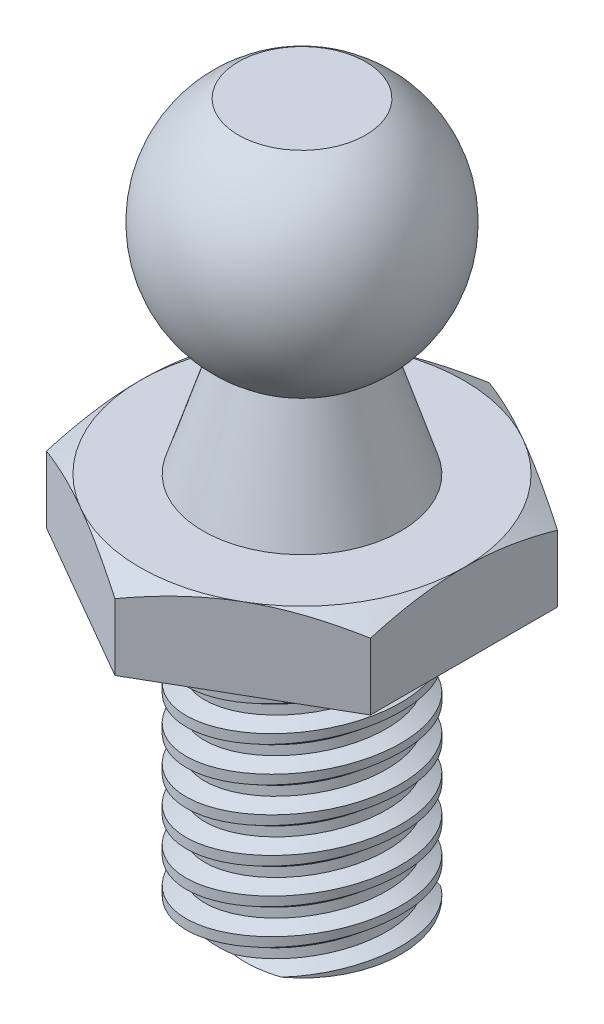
SolidWorks part; units mm, degrees
ref_plane "Front" through (0, 0, 0) normal (0, 0, 1) x (1, 0, 0)
ref_plane "Top" through (0, 0, 0) normal (0, 1, 0) x (1, 0, 0)
ref_plane "Right" through (0, 0, 0) normal (1, 0, 0) x (0, 0, -1)
sketch "Sketch1" plane through (0, 0, 0) normal (0, 0, 1) x (1, 0, 0)
  line L0 (0, -15.15) -> (0, 15.15)
  line L1 (0, 15.15) -> (2.5515, 15.15)
  line L2 (2.5515, 6.55) -> (3.9687, 2.1)
  line L3 (3.9687, 2.1) -> (6.5, 2.1)
  line L4 (6.5, 2.1) -> (6.5, -1.15)
  line L5 (6.5, -1.15) -> (3.9687, -1.15)
  line L6 (3.9687, -1.15) -> (3.9688, -15.15)
  line L7 (3.9688, -15.15) -> (0, -15.15)
  line L8 (2.5515, 6.55) -> (2.5515, 15.15) construction
  line L9 (0, -15.15) -> (0, -19.1187) construction
  line L10 (3.9687, 2.1) -> (3.9687, -1.15) construction
  line L11 (-3.9688, -1.15) -> (-3.9688, -15.15) construction
  arc A0 (2.5515, 15.15) -> (2.5515, 6.55) centre (0, 10.85) cw
revolve "Revolve1" add sketch "Sketch1" angle 360 about L9
sketch "Sketch2" plane through (0, 0, 0) normal (0, 0, 1) x (1, 0, 0)
  line L0 (3.9687, -1.15) -> (-3.9688, -1.15) construction
  line L1 (-3.9688, -1.15) -> (-3.9688, -2.5611) construction
  line L2 (-3.9688, -2.5611) -> (3.9687, -1.15) construction
  line L3 (3.9687, -1.15) -> (3.9996, -1.3237) construction
  line L4 (3.9996, -1.3237) -> (4.2157, -2.5393)
  line L5 (4.2157, -2.5393) -> (3.3866, -2.2389)
  line L6 (3.3866, -2.2389) -> (3.3248, -1.8915)
  line L7 (3.3248, -1.8915) -> (3.9996, -1.3237)
  line L8 (3.3557, -2.0652) -> (4.1077, -1.9315) construction
  line L9 (3.9687, -1.15) -> (3.9687, -1.9562) construction
  line L10 (3.9687, -1.9562) -> (-3.9688, -3.3673) construction
  line L11 (-3.9688, -3.3673) -> (-3.9688, -2.5611) construction
  line L12 (-0.2688, -1.15) -> (0.2688, -4.1735) construction
  line L13 (-3.9688, -1.15) -> (-3.9688, -15.15) construction
  line L14 (3.9687, -1.15) -> (3.9687, -15.15) construction
  line L15 (6.5, -1.15) -> (3.9687, -1.15) construction
  point P13 (0, -2.6618)
revolve "Cut-Revolve1" cut sketch "Sketch2" angle 360 about L12
sketch "Sketch3" plane through (0, 0, 0) normal (0, 0, 1) x (1, 0, 0)
  line L0 (3.3248, -15.15) -> (3.9687, -15.15)
  line L1 (3.9687, -15.15) -> (3.9687, -13.7691)
  line L2 (3.9687, -13.7691) -> (3.3248, -15.15)
  line L3 (3.9688, -15.15) -> (0, -15.15) construction
  line L4 (3.9687, -1.15) -> (3.9687, -15.15) construction
  line L5 (3.3248, -15.15) -> (3.3248, -1.8915) construction
  line L6 (0, -15.15) -> (0, 15.15) construction
  line L7 (0, -15.15) -> (0, 15.15) construction
  dimension "D1" = 25
revolve "Cut-Revolve2" cut sketch "Sketch3" angle 360 about L7
pattern_linear "LPattern1" count 10 spacing 1.4111 along (0, -1, 0) of "Cut-Revolve1"
sketch "Sketch4" plane through (0, -1.15, 0) normal (0, -1, 0) x (1, 0, 0)
  line L1 (6.5, 3.7528) -> (0, 7.5056)
  line L2 (0, 7.5056) -> (-6.5, 3.7528)
  line L3 (-6.5, 3.7528) -> (-6.5, -3.7528)
  line L4 (-6.5, -3.7528) -> (0, -7.5056)
  line L5 (0, -7.5056) -> (6.5, -3.7528)
  line L6 (6.5, -3.7528) -> (6.5, 3.7528)
  circle A0 centre (0, 0) radius 6.5 construction
extrude "Extrude1" add sketch "Sketch4" against normal up to surface (3.25 mm away)
sketch "Sketch5" plane through (0, 2.1, 0) normal (0, 1, 0) x (-1, 0, 0)
  circle A0 centre (0, 0) radius 6.5 construction
  circle A1 centre (0, 0) radius 6.5
extrude "Cut-Extrude1" cut sketch "Sketch5" against normal through all draft 60 flip side to cut
sketch "Sketch6" plane through (0, 0, 0) normal (0, 0, 1) x (1, 0, 0)
  line L0 (-3.3248, -15.15) -> (3.3248, -15.15) construction
  line L1 (-3.9688, -15.15) -> (3.9688, -15.15)
  line L2 (-3.9688, -15.15) -> (-3.9688, -12.61)
  line L3 (-3.9688, -12.61) -> (3.9688, -12.61)
  line L4 (3.9688, -15.15) -> (3.9688, -12.61)
  line L5 (-3.9688, -12.4405) -> (-3.9688, -12.7515) construction
  line L6 (3.9688, -12.6385) -> (3.9688, -12.3276) construction
  dimension "D1" = 2.54
extrude "Remove .10\" From Length" cut sketch "Sketch6" against normal mid plane 9.525
equation "\"D1@Sketch2\"=\"Thread Pitch@Sketch2\""
equation "\"D3@Sketch2\"=\"Thread Pitch@Sketch2\"/4"
equation "\"D2@Sketch2\"=\"Thread Pitch@Sketch2\"/8"
equation "\"D3@LPattern1\"=\"Thread Pitch@Sketch2\""
equation "\"D1@LPattern1\"=\"Thread length@Sketch1\"/\"Thread Pitch@Sketch2\""
equation "\"D2@Sketch1\" = \"Hex@Sketch1\"/4"
